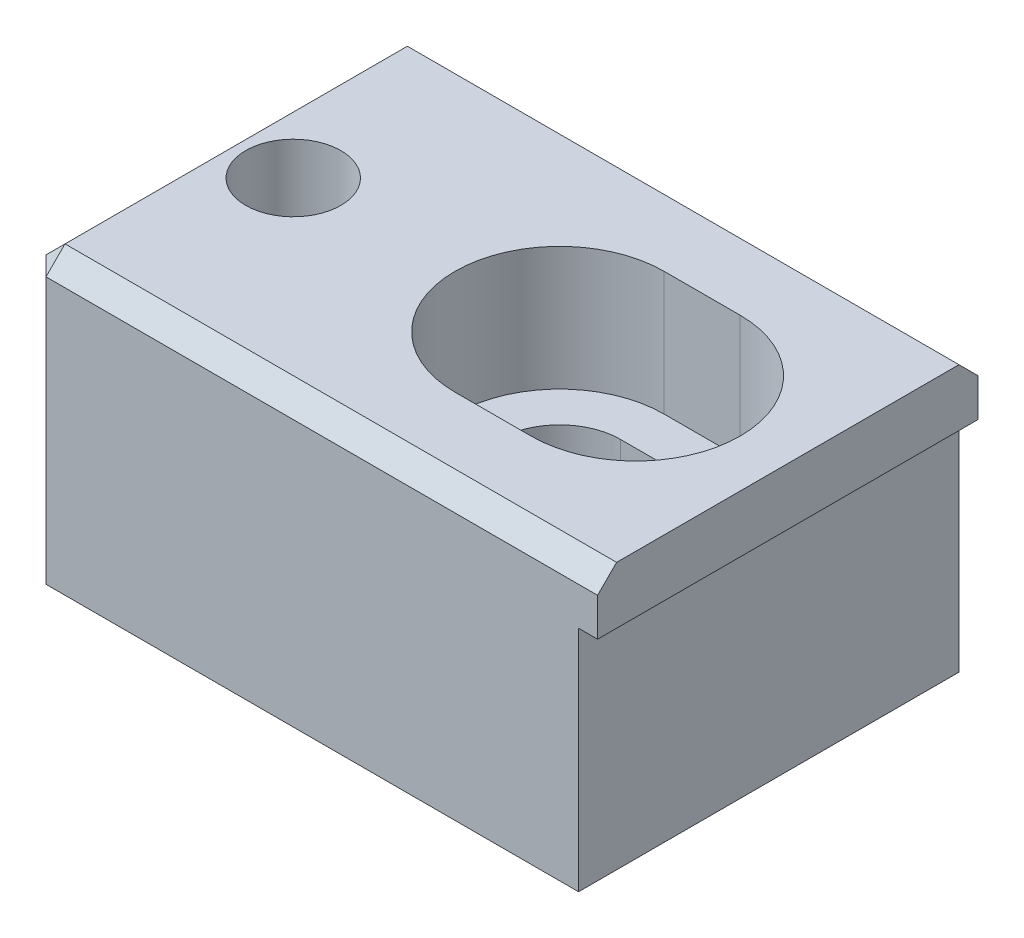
SolidWorks part; units mm, degrees
ref_plane "Plan de face" through (0, 0, 0) normal (0, 0, 1) x (1, 0, 0)
ref_plane "Plan de dessus" through (0, 0, 0) normal (0, 1, 0) x (1, 0, 0)
ref_plane "Plan de droite" through (0, 0, 0) normal (1, 0, 0) x (0, 0, -1)
sketch "Esquisse1" plane through (0, 0, 0) normal (0, 0, 1) x (1, 0, 0)
  line L1 (-27.6, 25) -> (2.4, 25)
  line L2 (-27.6, 25) -> (-27.6, 10)
  line L3 (-27.6, 10) -> (1.4, 10)
  line L4 (2.4, 25) -> (2.4, 22)
  line L5 (2.5, 10) -> (2.5, 25) construction
  line L6 (-28, 0) -> (83, 0) construction
  line L7 (2.4, 22) -> (1.4, 22)
  line L8 (1.4, 22) -> (1.4, 10)
  dimension "D1" = 10
  dimension "D2" = 0.1
  dimension "D3" = 15
  dimension "D4" = 30
  dimension "D5" = 3
  dimension "D6" = 1
extrude "Boss.-Extru.1" add sketch "Esquisse1" along normal mid plane 20
chamfer "Chanfrein1" distance 1 angle 45 5 edges at (-12.6, 25, 10) (-12.6, 25, -10) (-27.6, 17.5, 10) (-27.6, 25, 0) (-27.6, 17.5, -10)
sketch "Esquisse2" plane through (0, 25, 0) normal (0, 1, 0) x (1, 0, 0)
  line L0 (2.4, 0) -> (-26.6, 0) construction
  line L1 (2.4, -9) -> (2.4, 9) construction
  line L2 (-26.6, 9) -> (-26.6, -9) construction
  point P6 (-23.6, 0)
  dimension "D1" = 3
hole_wizard "Trou taraudé M61" positions "Esquisse4" profile "Esquisse3" tap size "M6" standard "Iso"
sketch "Esquisse4" plane through (0, 25, 0) normal (0, 1, 0) x (1, 0, 0)
  point P0 (-23.6, 0)
sketch "Esquisse3" plane through (-23.6, 25, 0) normal (1, 0, 0) x (0, 0, 1)
  line L0 (0, 0) -> (0, 15)
  line L1 (0, 15) -> (2.5, 15)
  line L2 (2.5, 15) -> (2.5, 0)
  line L5 (2.5, 0) -> (0, 0)
  line L11 (0, -6.35) -> (0, 107.95) construction
  dimension "Diamètre du trou pour taraudage jusqu'au prochain" = 5
  dimension "Profondeur du trou pour taraudage jusqu'au prochain" = 15
sketch "Esquisse13" plane through (0, 25, 0) normal (0, 1, 0) x (1, 0, 0)
  line L0 (-9.6, 0) -> (-5.6, 0) construction
  line L1 (2.4, 0) -> (-26.6, 0) construction
  line L2 (-9.6, 5.5) -> (-5.6, 5.5)
  line L3 (-9.6, -5.5) -> (-5.6, -5.5)
  line L4 (2.4, -9) -> (2.4, 9) construction
  arc A0 (-9.6, 5.5) -> (-9.6, -5.5) centre (-9.6, 0) ccw
  arc A1 (-5.6, -5.5) -> (-5.6, 5.5) centre (-5.6, 0) ccw
  point P4 (-7.6, 0)
  dimension "D1" = 5.5
  dimension "D2" = 8
  dimension "D3" = 4
extrude "Enlèv. mat.-Extru.1" cut sketch "Esquisse13" against normal blind 6.5
sketch "Esquisse14" plane through (0, 18.5, 0) normal (0, 1, 0) x (1, 0, 0)
  line L0 (-9.6, 0) -> (-5.6, 0) construction
  line L1 (-9.6, 3.2) -> (-5.6, 3.2)
  line L2 (-9.6, -3.2) -> (-5.6, -3.2)
  arc A0 (-9.6, 3.2) -> (-9.6, -3.2) centre (-9.6, 0) ccw
  arc A1 (-5.6, -3.2) -> (-5.6, 3.2) centre (-5.6, 0) ccw
  arc A2 (-9.6, 5.5) -> (-9.6, -5.5) centre (-9.6, 0) ccw construction
  arc A3 (-5.6, -5.5) -> (-5.6, 5.5) centre (-5.6, 0) ccw construction
  point P2 (-7.6, 0)
  dimension "D1" = 3.2
extrude "Enlèv. mat.-Extru.2" cut sketch "Esquisse14" against normal through all
